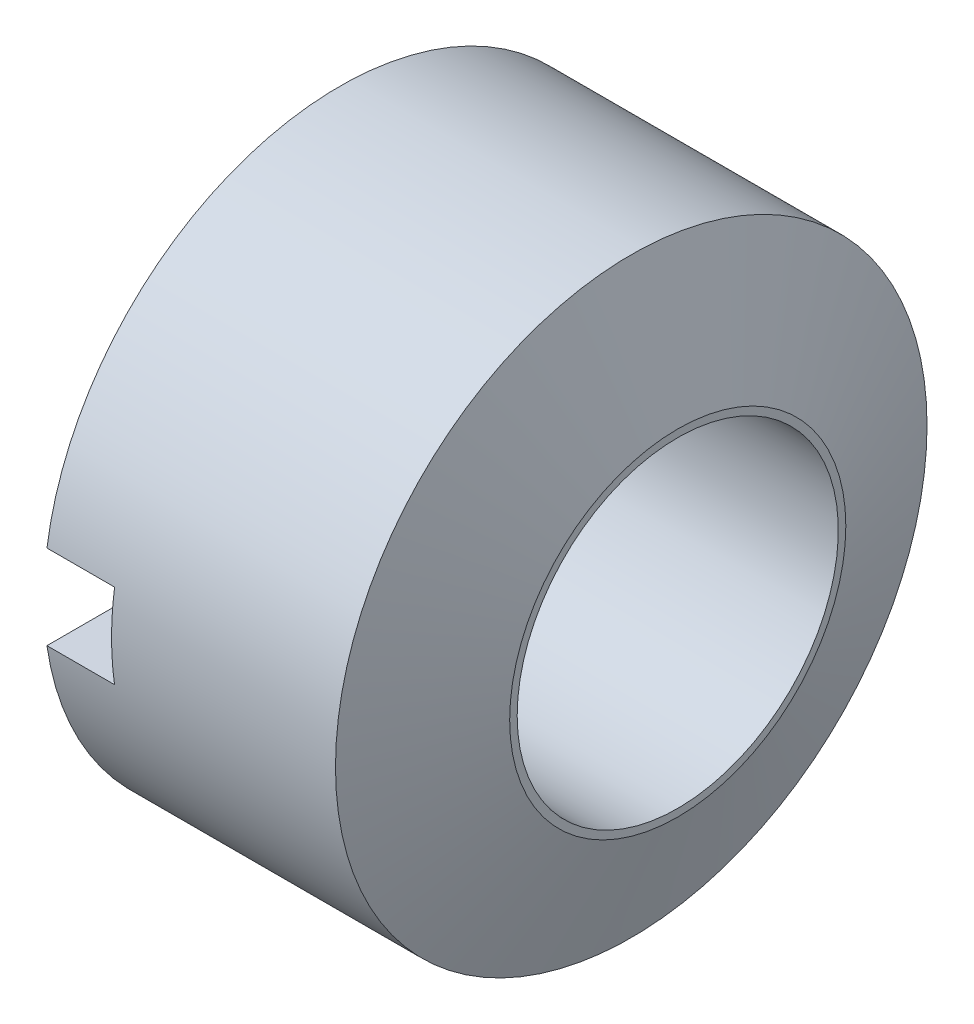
SolidWorks part; units mm, degrees
ref_plane "Vorne" through (0, 0, 0) normal (0, 0, 1) x (1, 0, 0)
ref_plane "Oben" through (0, 0, 0) normal (0, 1, 0) x (1, 0, 0)
ref_plane "Rechts" through (0, 0, 0) normal (1, 0, 0) x (0, 0, -1)
sketch "Skizze1" plane through (0, 0, 0) normal (0, 0, 1) x (1, 0, 0)
  line L5 (13.8494, 1.9) -> (13.8494, 1.9889) construction
  line L6 (13.2994, 3.5) -> (13.8494, 1.9889) construction
  line L7 (13.8494, 1.9) -> (9.8494, 1.9) construction
  line L8 (0, 0) -> (79.1682, 0) construction
  line L9 (0, 0) -> (79.1682, 0) construction
  line L11 (9.8494, 3.5) -> (13.2994, 3.5) construction
  line L12 (9.8494, 1.9) -> (9.8494, 3.5) construction
  line L13 (13.8494, 1.9) -> (13.8494, 1.9889)
  line L14 (13.2994, 3.5) -> (13.8494, 1.9889)
  line L15 (13.8494, 1.9) -> (9.8494, 1.9)
  line L16 (9.8494, 3.5) -> (13.2994, 3.5)
  line L17 (9.8494, 1.9) -> (9.8494, 3.5)
revolve "Rotation1" add sketch "Skizze1" angle 360 about L9
sketch "Skizze4" plane through (0, 0, 0) normal (0, 0, 1) x (1, 0, 0)
  line L0 (9.8494, 3.5) -> (9.8494, -3.5) construction
  line L1 (9.8494, 0.5) -> (10.6494, 0.5)
  line L2 (9.8494, 0.5) -> (9.8494, -0.5)
  line L3 (9.8494, -0.5) -> (10.6494, -0.5)
  line L4 (10.6494, 0.5) -> (10.6494, -0.5)
  line L5 (10.6494, 0) -> (13.8494, 0) construction
  line L6 (13.8494, -1.9889) -> (13.8494, 1.9889) construction
  dimension "D1" = 1
  dimension "D2" = 0.8
extrude "Linear austragen1" cut sketch "Skizze4" against normal mid plane 40
